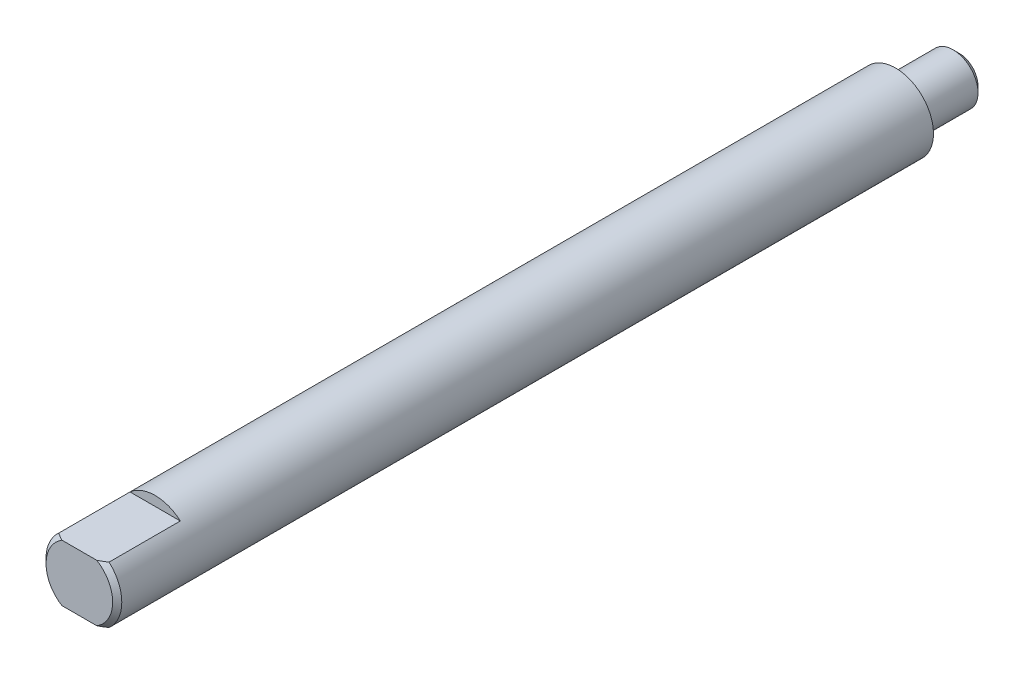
SolidWorks part; units mm, degrees
ref_plane "Front" through (0, 0, 0) normal (0, 0, 1) x (1, 0, 0)
ref_plane "Top" through (0, 0, 0) normal (0, 1, 0) x (1, 0, 0)
ref_plane "Right" through (0, 0, 0) normal (1, 0, 0) x (0, 0, -1)
sketch "Sketch1" plane through (0, 0, 0) normal (1, 0, 0) x (0, 0, -1)
  line L0 (69.6468, 1.57) -> (69.1368, 2.0828)
  line L1 (-4.064, 0) -> (69.6468, 0)
  line L2 (-4.064, 0) -> (-4.064, 2.79)
  line L3 (-3.684, 3.175) -> (64.3128, 3.175)
  line L4 (64.3128, 2.0828) -> (64.3128, 3.175)
  line L5 (153.7208, 0) -> (-49846.2792, 0) construction
  line L6 (-4.064, 2.79) -> (-3.684, 3.175)
  line L7 (64.3128, 2.0828) -> (69.1368, 2.0828)
  line L8 (69.6468, 0) -> (69.6468, 1.57)
  point P2 (0, 0)
  point P12 (-5.4362, 3.2626)
  dimension "D1" = 68.3768
  dimension "D2" = 3.175
  dimension "D3" = 4.1656
  dimension "D4" = 5.334
  dimension "D5" = 1.57
  dimension "D6" = 0.51
  dimension "D7" = 2.79
  dimension "D8" = 0.38
  dimension "D9" = 4.064
revolve "Revolve1" add sketch "Sketch1" angle 360 about L1
sketch "Sketch2" plane through (0, 0, 0) normal (1, 0, 0) x (0, 0, -1)
  line L0 (-4.064, 2.79) -> (-4.064, -2.79) construction
  line L1 (-4.064, 2.375) -> (2.286, 2.375)
  line L2 (-4.064, 2.375) -> (-4.064, 3.175)
  line L3 (-4.064, 3.175) -> (2.286, 3.175)
  line L4 (2.286, 2.375) -> (2.286, 3.175)
  line L5 (64.3128, 3.175) -> (-3.684, 3.175) construction
  line L6 (0, 0) -> (6.0811, 0) construction
  line L7 (2.286, -2.375) -> (2.286, -3.175)
  line L8 (-4.064, -3.175) -> (2.286, -3.175)
  line L9 (-4.064, -2.375) -> (-4.064, -3.175)
  line L10 (-4.064, -2.375) -> (2.286, -2.375)
  dimension "D1" = 0.8
  dimension "D2" = 6.35
extrude "Cut-Extrude1" cut sketch "Sketch2" against normal mid plane 10
